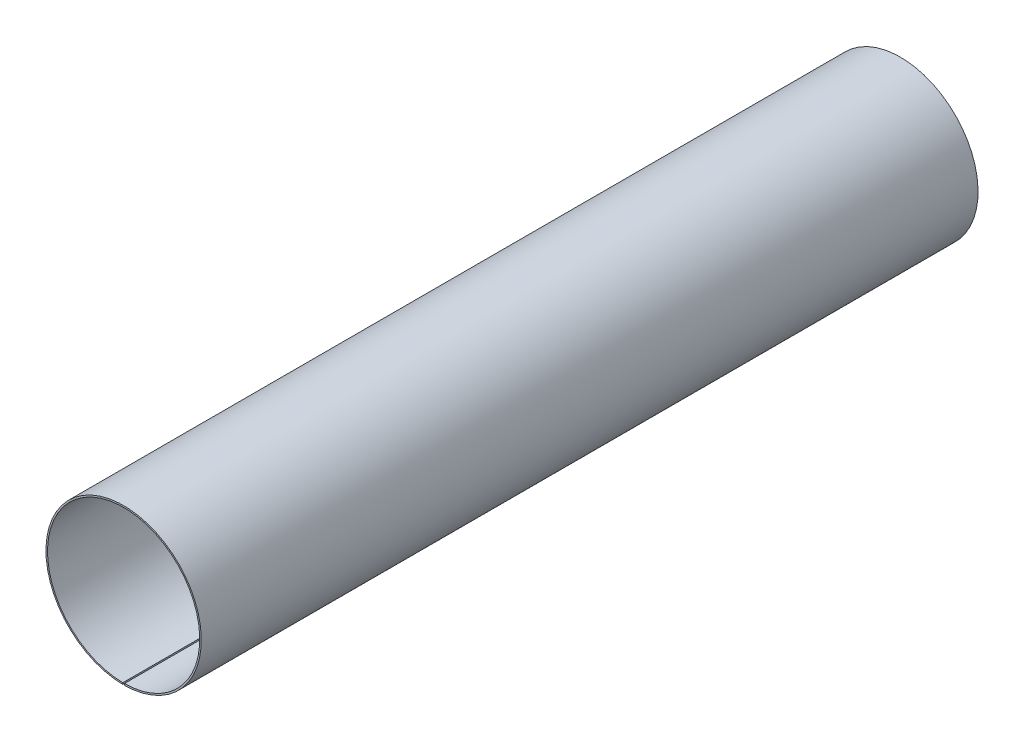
SolidWorks part; units mm, degrees
ref_plane "前视基准面" through (0, 0, 0) normal (0, 0, 1) x (1, 0, 0)
ref_plane "上视基准面" through (0, 0, 0) normal (0, 1, 0) x (1, 0, 0)
ref_plane "右视基准面" through (0, 0, 0) normal (1, 0, 0) x (0, 0, -1)
sketch "草图1" plane through (0, 0, 0) normal (0, 0, 1) x (1, 0, 0)
  line L0 (0, 0) -> (500, 0) construction
  line L1 (0, 0) -> (0, -1) construction
  circle A0 centre (0, 0) radius 50
  dimension "d" = 100
  dimension "h" = 500
  dimension "t" = 1
extrude "拉伸-薄壁1" add sketch "草图1" along normal blind 500 thin
sketch "草图2" plane through (0, 0, 0) normal (0, 1, 0) x (1, 0, 0)
  line L0 (0, 0) -> (0, -500)
  dimension "D1" = 500
extrude "切除-拉伸-薄壁1" cut sketch "草图2" against normal through all thin
sheet metal parameters "钣金1" parameters "D1"=0.7366, "厚度"=1
bend "圆角折弯1" bend radius 49 bend angle 358.854 parameters "D5"=1
flatten bends "展开-折弯1"
sketch "尖角-草图1" plane through (0.5, -49.9975, 250) normal (0.01, -0.9999, 0) x (0.9999, 0.01, 0)
  line L0 (153.448, 250) -> (153.448, -250) construction
  dimension "D1" = 0
process bends "加工-折弯1" parameters "D1"=0
sketch "平面-草图1" plane through (0.5, -49.9975, 250) normal (0.01, -0.9999, 0) x (0.9999, 0.01, 0)
equation "\"D1@拉伸-薄壁1\" = \"h@草图1\""
equation "\"D2@拉伸-薄壁1\" = \"t@草图1\""
equation "\"D1@草图2\" = \"h@草图1\""
